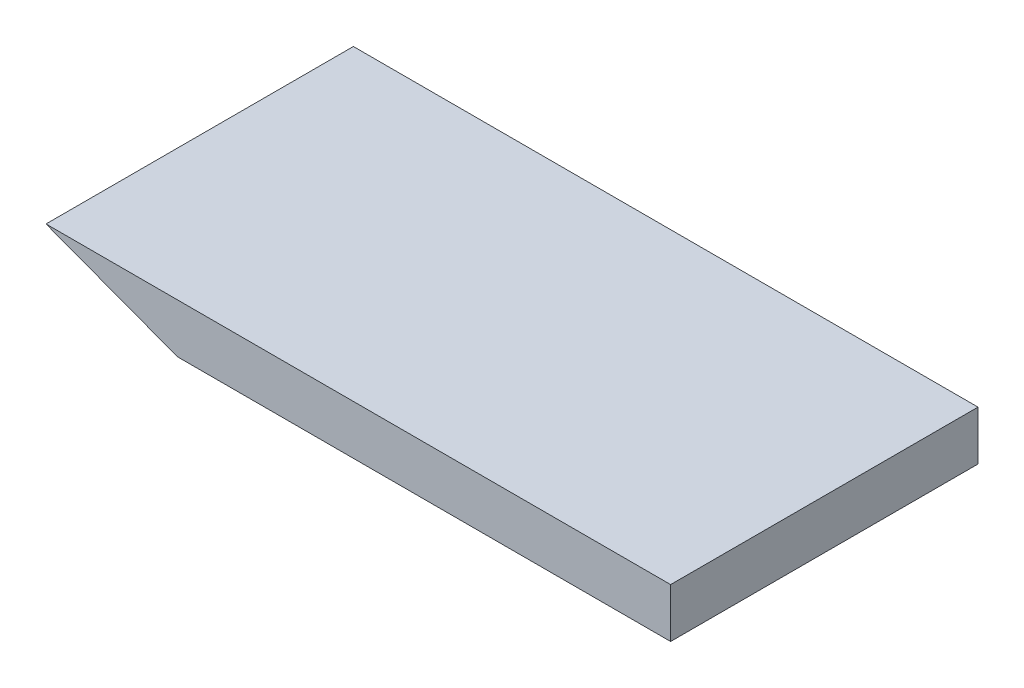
SolidWorks part; units mm, degrees
ref_plane "Front Plane" through (0, 0, 0) normal (0, 0, 1) x (1, 0, 0)
ref_plane "Top Plane" through (0, 0, 0) normal (0, 1, 0) x (1, 0, 0)
ref_plane "Right Plane" through (0, 0, 0) normal (1, 0, 0) x (0, 0, -1)
sketch "Sketch1" plane through (0, 0, 0) normal (0, 1, 0) x (1, 0, 0)
  line L1 (-19, 9.35) -> (19, 9.35)
  line L2 (-19, 9.35) -> (-19, -9.35)
  line L3 (-19, -9.35) -> (19, -9.35)
  line L4 (19, 9.35) -> (19, -9.35)
  line L5 (-19, 9.35) -> (19, -9.35) construction
  line L6 (-19, -9.35) -> (19, 9.35) construction
  point P0 (0, 0)
  dimension "D1" = 38
  dimension "D2" = 18.7
extrude "Boss-Extrude1" add sketch "Sketch1" along normal blind 3
sketch "Sketch2" plane through (0, 0, 9.35) normal (0, 0, 1) x (1, 0, 0)
  line L0 (-19, 3) -> (-19, 0)
  line L1 (-19, 0) -> (-11, 0)
  line L2 (-19, 0) -> (19, 0) construction
  line L3 (-11, 0) -> (-19, 3)
  dimension "D1" = 3
  dimension "D2" = 8
extrude "Cut-Extrude1" cut sketch "Sketch2" against normal through all both and the other way through all
